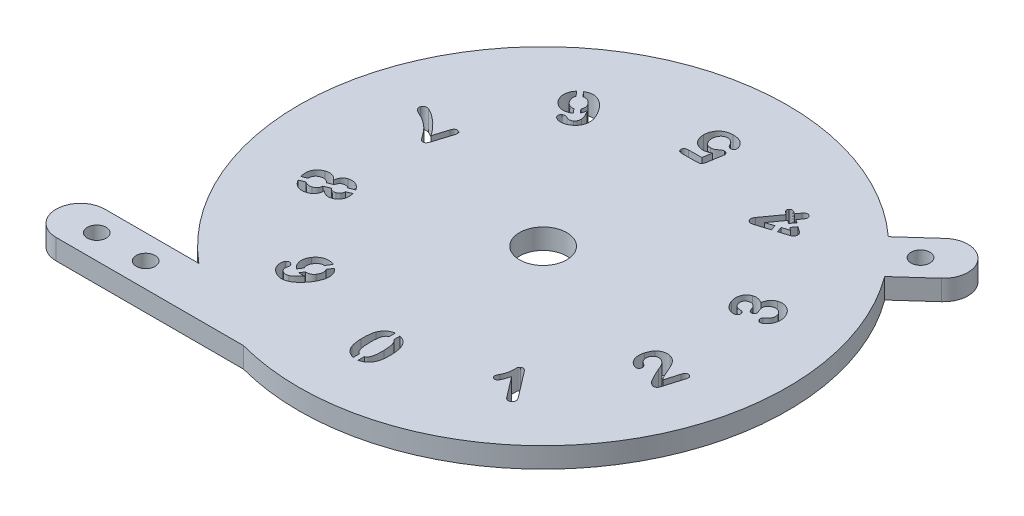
SolidWorks part; units mm, degrees
ref_plane "Front Plane" through (0, 0, 0) normal (0, 0, 1) x (1, 0, 0)
ref_plane "Top Plane" through (0, 0, 0) normal (0, 1, 0) x (1, 0, 0)
ref_plane "Right Plane" through (0, 0, 0) normal (1, 0, 0) x (0, 0, -1)
sketch "Sketch1" plane through (0, 0, 0) normal (0, 1, 0) x (1, 0, 0)
  circle A0 centre (0, 0) radius 38.1
  circle A1 centre (0, 0) radius 3.683
  dimension "D1" = 76.2
  dimension "D2" = 7.366
extrude "Boss-Extrude1" add sketch "Sketch1" along normal blind 3.175
sketch "Sketch5" plane through (0, 3.175, 3.175) normal (0, 1, 0) x (1, 0, 0)
  circle A2 centre (0, 3.175) radius 29.8889 construction
  text T2 "   3      4      5      6      7      8      9      0      1      2" font "Arial Rounded MT Bold" height in points 26
extrude "Cut-Extrude1" cut sketch "Sketch5" against normal through all
sketch "Sketch6" plane through (0, 0, 0) normal (0, 1, 0) x (1, 0, 0)
  line L0 (-18.7065, 24.0232) -> (-18.1211, 24.511)
  line L1 (-18.7065, 24.0232) -> (-15.2377, 19.8606)
  line L2 (-18.1211, 24.511) -> (-14.6523, 20.3484)
  line L3 (-15.2377, 19.8606) -> (-14.6523, 20.3484)
  line L4 (-28.951, -9.7275) -> (-28.6655, -10.434)
  line L5 (-28.951, -9.7275) -> (-20.5517, -6.334)
  line L6 (-28.6655, -10.434) -> (-20.2663, -7.0405)
  line L7 (-20.5517, -6.334) -> (-20.2663, -7.0405)
  line L8 (0, 0) -> (-51.4446, 0) construction
  line L9 (-13.7467, -18.5792) -> (-13.1076, -18.9942)
  line L10 (0.2076, -22.2833) -> (0.9696, -22.2833)
  line L11 (0.2076, -22.2833) -> (0.2076, -31.3974)
  line L12 (0.2076, -31.3974) -> (0.9696, -31.3974)
  line L13 (0.9696, -22.2833) -> (0.9696, -31.3974)
  line L14 (-13.7467, -18.5792) -> (-16.3642, -22.6099)
  line L15 (-13.1076, -18.9942) -> (-15.7252, -23.0249)
  line L16 (-16.3642, -22.6099) -> (-15.7252, -23.0249)
  line L17 (15.1968, 21.2088) -> (15.6897, 19.6668)
  line L18 (14.0843, 20.4579) -> (17.1323, 21.4321) construction
  line L19 (15.9226, 21.4408) -> (16.4155, 19.8988)
  line L20 (15.6897, 19.6668) -> (16.4155, 19.8988)
  line L21 (15.9226, 21.4408) -> (15.1968, 21.2088)
  line L22 (16.5467, 21.551) -> (17.5092, 22.8859)
  line L23 (17.1323, 21.4321) -> (15.5894, 22.5446) construction
  line L24 (15.9286, 21.9967) -> (16.8911, 23.3316)
  line L25 (16.5467, 21.551) -> (15.9286, 21.9967)
  line L26 (16.8911, 23.3316) -> (17.5092, 22.8859)
  dimension "D1" = 0.762
  dimension "D2" = 0.762
  dimension "D3" = 22
  dimension "D4" = 0.762
  dimension "D5" = 0.762
  dimension "D6" = 57
  dimension "D7" = 0.762
  dimension "D8" = 0.762
extrude "Boss-Extrude3" add sketch "Sketch6" along normal blind 3.175
sketch "Sketch7" plane through (0, 0, 0) normal (0, 1, 0) x (1, 0, 0)
  line L0 (-39.1592, -32.9721) -> (-9.9342, -32.9721) construction
  line L1 (-39.1592, -29.1621) -> (-9.9342, -29.1621)
  line L2 (-39.1592, -36.7821) -> (-9.9342, -36.7821)
  line L3 (-39.1592, -29.1621) -> (-39.1592, -36.7821) construction
  line L4 (0, 38.1) -> (0, -38.1) construction
  line L5 (-36.6192, -32.9721) -> (0, 0) construction
  line L6 (0, 0) -> (30.9564, 27.8733) construction
  line L7 (23.7836, 21.4149) -> (32.844, 29.5729) construction
  line L8 (21.2342, 24.2462) -> (30.2946, 32.4043)
  line L9 (26.333, 18.5835) -> (35.3934, 26.7415)
  line L10 (30.2946, 32.4043) -> (35.3934, 26.7415) construction
  arc A0 (-39.1592, -29.1621) -> (-39.1592, -36.7821) centre (-39.1592, -32.9721) ccw
  arc A1 (-9.9342, -36.7821) -> (-9.9342, -29.1621) centre (-9.9342, -32.9721) ccw
  circle A2 centre (0, 0) radius 38.1 construction
  arc A3 (21.2342, 24.2462) -> (26.333, 18.5835) centre (23.7836, 21.4149) ccw
  arc A4 (35.3934, 26.7415) -> (30.2946, 32.4043) centre (32.844, 29.5729) ccw
  point P2 (-24.5467, -32.9721)
  point P11 (-36.6192, -32.9721)
  point P18 (-28.9992, -32.9721)
  point P22 (28.3138, 25.4939)
  point P28 (30.9564, 27.8733)
  dimension "D1" = 7.62
  dimension "D2" = 49.276
  dimension "D3" = 48
  dimension "D4" = 7.62
  dimension "D5" = 2.54
  dimension "D6" = 41.656
  dimension "D7" = 2.54
extrude "Boss-Extrude4" add sketch "Sketch7" along normal blind 3.175
hole_wizard "#4 Clearance Hole2" positions "Sketch9" profile "Sketch8" hole size "#4" standard "ANSI Inch"
sketch "Sketch9" plane through (0, 3.175, 0) normal (0, 1, 0) x (1, 0, 0)
  point P0 (-36.6192, -32.9721)
  point P3 (-28.9992, -32.9721)
  point P12 (30.9564, 27.8733)
sketch "Sketch8" plane through (-36.6192, 3.175, 32.9721) normal (1, 0, 0) x (0, 0, 1)
  line L0 (0, 0) -> (0, 3.175)
  line L1 (0, 3.175) -> (1.4732, 3.175)
  line L2 (1.4732, 3.175) -> (1.4732, 0)
  line L5 (1.4732, 0) -> (0, 0)
  line L11 (0, -6.35) -> (0, 107.95) construction
  dimension "Thru Hole Dia." = 2.9464
  dimension "Thru Hole Depth" = 3.175
